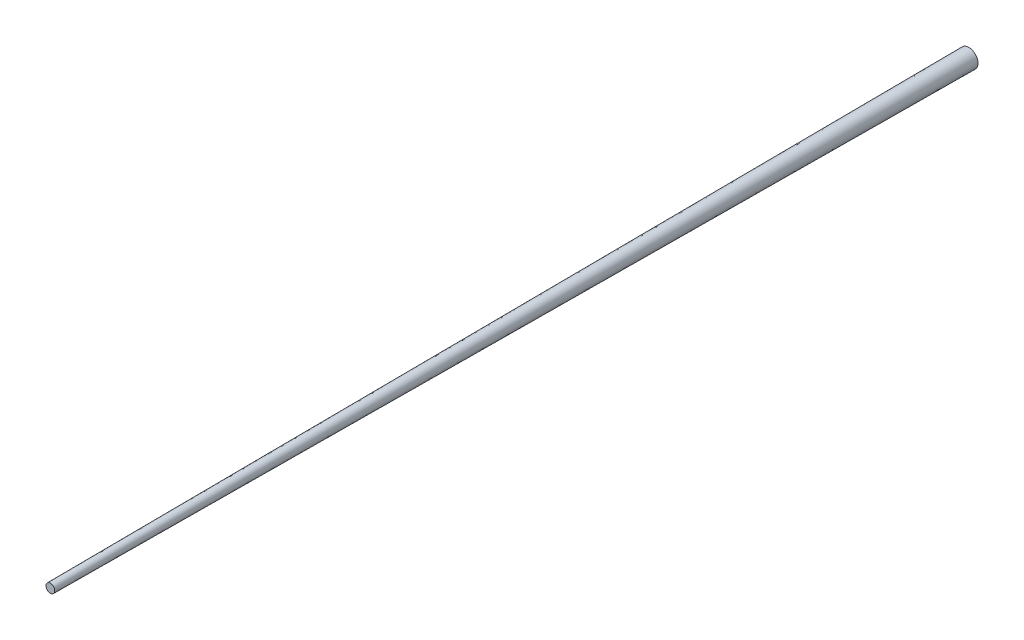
SolidWorks part; units mm, degrees
ref_plane "Plan de face" through (0, 0, 0) normal (0, 0, 1) x (1, 0, 0)
ref_plane "Plan de dessus" through (0, 0, 0) normal (0, 1, 0) x (1, 0, 0)
ref_plane "Plan de droite" through (0, 0, 0) normal (1, 0, 0) x (0, 0, -1)
sketch "Esquisse1" plane through (0, 0, 0) normal (0, 0, 1) x (1, 0, 0)
  circle A0 centre (0, 0) radius 50
  dimension "D1" = 100
extrude "Extrusion1" add sketch "Esquisse1" along normal blind 5000 draft 0.3
